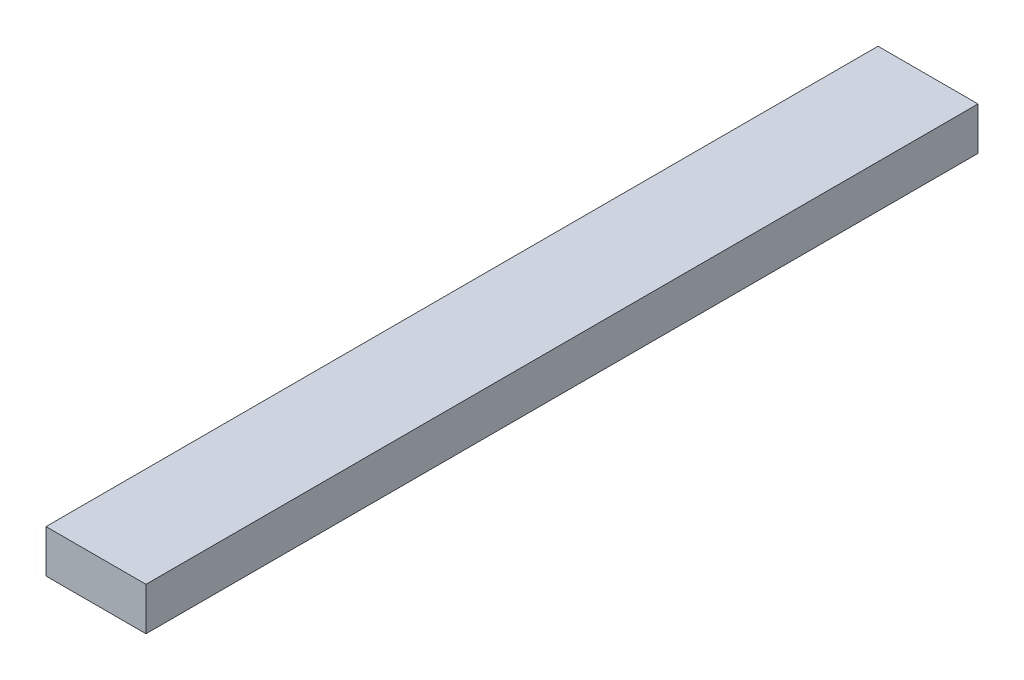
SolidWorks part; units mm, degrees
ref_plane "Front Plane" through (0, 0, 0) normal (0, 0, 1) x (1, 0, 0)
ref_plane "Top Plane" through (0, 0, 0) normal (0, 1, 0) x (1, 0, 0)
ref_plane "Right Plane" through (0, 0, 0) normal (1, 0, 0) x (0, 0, -1)
sketch "Sketch1" plane through (0, 0, 0) normal (0, 1, 0) x (1, 0, 0)
  line L0 (0, 0) -> (0, -739.775)
  line L1 (0, -739.775) -> (-88.9, -739.775)
  line L2 (-88.9, -739.775) -> (-88.9, 0)
  line L3 (-88.9, 0) -> (0, 0)
  dimension "D1" = 739.775
  dimension "D3" = 88.9
extrude "Boss-Extrude1" add sketch "Sketch1" along normal blind 38.1
